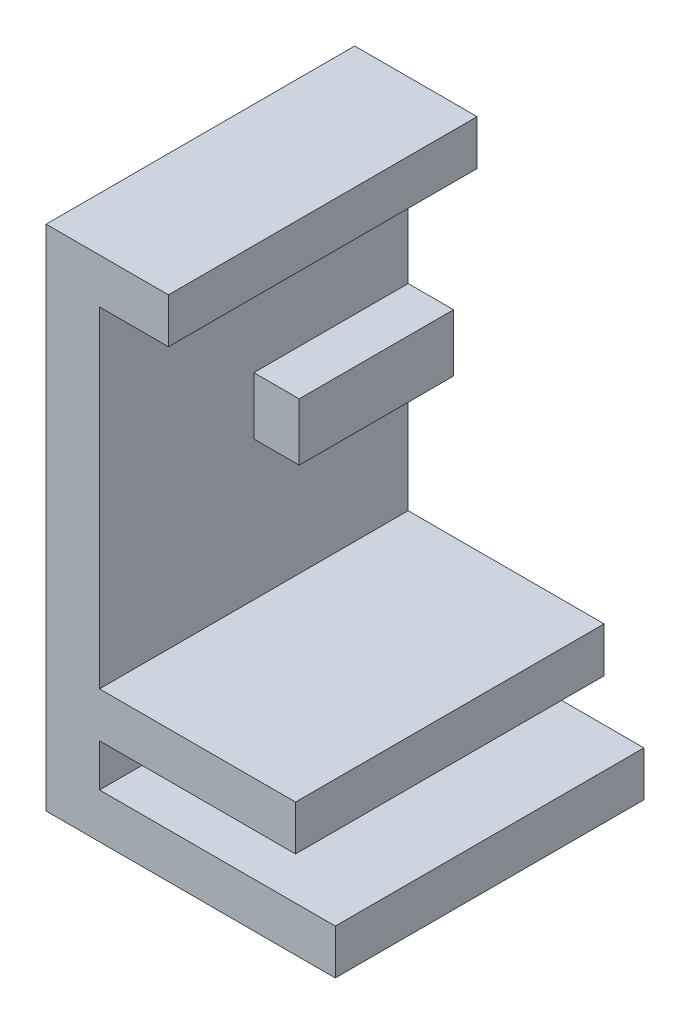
SolidWorks part; units mm, degrees
ref_plane "Front" through (0, 0, 0) normal (0, 0, 1) x (1, 0, 0)
ref_plane "Top" through (0, 0, 0) normal (0, 1, 0) x (1, 0, 0)
ref_plane "Right" through (0, 0, 0) normal (1, 0, 0) x (0, 0, -1)
sketch "Sketch1" plane through (8.5643, -28.3878, 0) normal (0, 0, 1) x (0, 1, 0)
  line L0 (-58.1634, -54.4213) -> (98.2773, -54.4213)
  line L1 (-31.2198, -131.2019) -> (-17.3789, -131.2019)
  line L2 (-17.3789, -131.2019) -> (-17.3789, -70.8632)
  line L4 (98.2773, -54.4213) -> (98.2773, -92.0903)
  line L6 (-58.1634, -143.4403) -> (-58.1634, -54.4213)
  line L16 (-131.7247, -54.4213) -> (174.6253, -54.4213) construction
  line L17 (-17.3789, -70.8632) -> (25.4963, -70.8632)
  line L18 (43.1793, -70.8632) -> (84.4364, -70.8632)
  line L19 (43.1793, -84.8357) -> (43.1793, -70.8632)
  line L20 (25.4963, -84.8357) -> (43.1793, -84.8357)
  line L21 (25.4963, -70.8632) -> (25.4963, -84.8357)
  line L24 (-31.2198, -70.8632) -> (-31.2198, -131.2019)
  line L25 (-58.1634, -143.4403) -> (-44.3225, -143.4403)
  line L26 (84.4364, -92.0903) -> (98.2773, -92.0903)
  line L27 (84.4364, -70.8632) -> (84.4364, -92.0903)
  line L28 (-44.3225, -70.8632) -> (-31.2198, -70.8632)
  line L29 (-44.3225, -143.4403) -> (-44.3225, -70.8632)
extrude "Extrude1" add sketch "Sketch1" along normal mid plane 95
ref_plane "Plane1" through (0, 79.8894, 0) normal (0, 1, 0) x (-1, 0, 0)
sketch "Sketch3" plane through (0, 14.7915, 0) normal (0, 1, 0) x (-1, 0, 0)
  line L0 (-79.4274, 0) -> (-93.3999, 0)
  line L4 (-93.3999, -47.5) -> (-79.4274, -47.5)
  line L5 (-79.4274, -47.5) -> (-79.4274, 47.5)
  line L6 (-79.4274, 47.5) -> (-93.3999, 47.5)
  line L7 (-93.3999, 47.5) -> (-93.3999, -47.5)
  line L9 (-79.4274, 0) -> (-79.4274, 47.5)
  line L10 (-79.4274, 47.5) -> (-93.3999, 47.5)
  line L11 (-93.3999, 47.5) -> (-93.3999, 0)
  dimension "D1" = 0
extrude "Cut-Extrude1" cut sketch "Sketch3" against normal up to next
sketch "Sketch2" plane through (0, 79.8894, 0) normal (0, 1, 0) x (-1, 0, 0)
  circle A0 centre (-118.9971, 0) radius 15.9977
